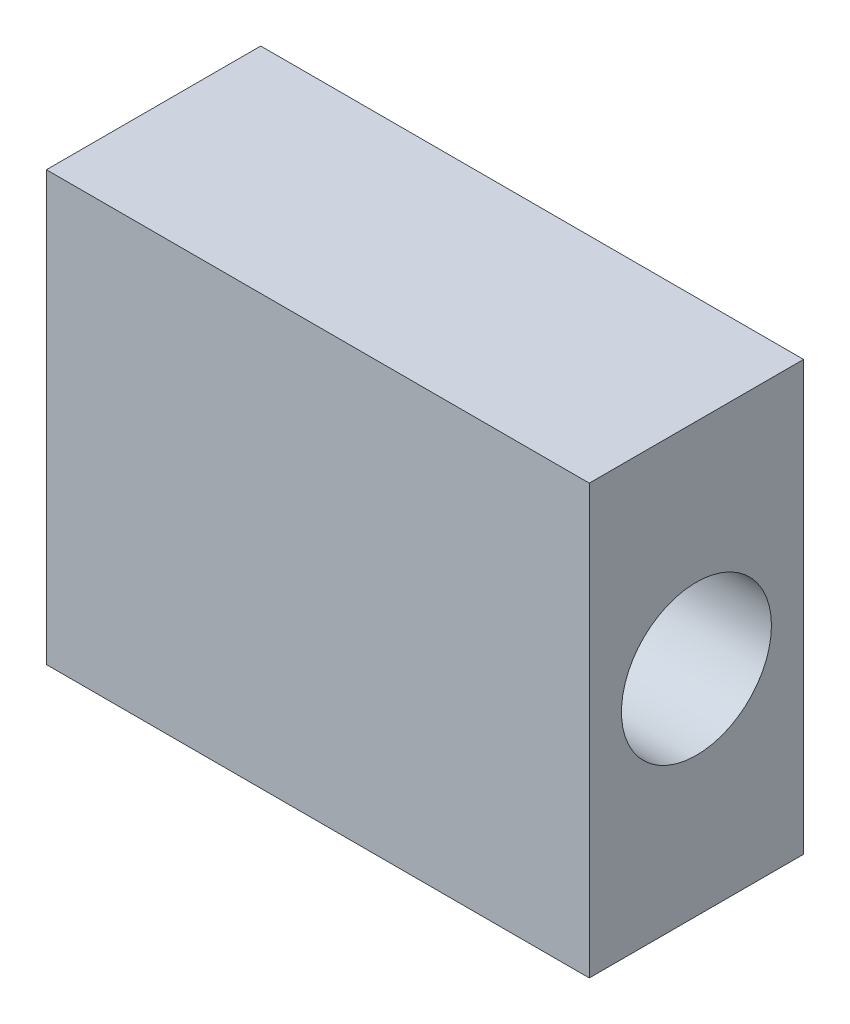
SolidWorks part; units mm, degrees
ref_plane "Plan de face" through (0, 0, 0) normal (0, 0, 1) x (1, 0, 0)
ref_plane "Plan de dessus" through (0, 0, 0) normal (0, 1, 0) x (1, 0, 0)
ref_plane "Plan de droite" through (0, 0, 0) normal (1, 0, 0) x (0, 0, -1)
sketch "Esquisse1" plane through (0, 0, 0) normal (0, 0, 1) x (1, 0, 0)
  line L1 (0, 0) -> (38, 0)
  line L2 (0, 0) -> (0, 30)
  line L3 (0, 30) -> (38, 30)
  line L4 (38, 0) -> (38, 30)
  dimension "D1" = 38
  dimension "D2" = 30
extrude "Extrusion1" add sketch "Esquisse1" along normal blind 15
hole_wizard "Trou taraudé M12x1.51" positions "Esquisse3" profile "Esquisse2" tap size "M12x1.5" standard "ISO"
sketch "Esquisse3" plane through (38, 0, 0) normal (1, 0, 0) x (0, 0, -1)
  line L0 (-15, 30) -> (0, 30) construction
  line L1 (-15, 0) -> (-15, 30) construction
  point P0 (-7.5, 15)
  dimension "D1" = 15
  dimension "D2" = 7.5
sketch "Esquisse2" plane through (38, 15, 7.5) normal (0, 1, 0) x (0, 0, -1)
  line L0 (0, 0) -> (0, 29.6545)
  line L1 (0, 29.6545) -> (5.25, 26.5)
  line L2 (5.25, 26.5) -> (5.25, 0)
  line L5 (5.25, 0) -> (0, 0)
  line L10 (0, 29.6545) -> (-5.25, 26.5) construction
  line L11 (0, -6.35) -> (0, 107.95) construction
  dimension "Diamètre du trou pour taraudage" = 10.5
  dimension "Profondeur du trou pour taraudage" = 26.5
  dimension "Angle de pointe" = 118
